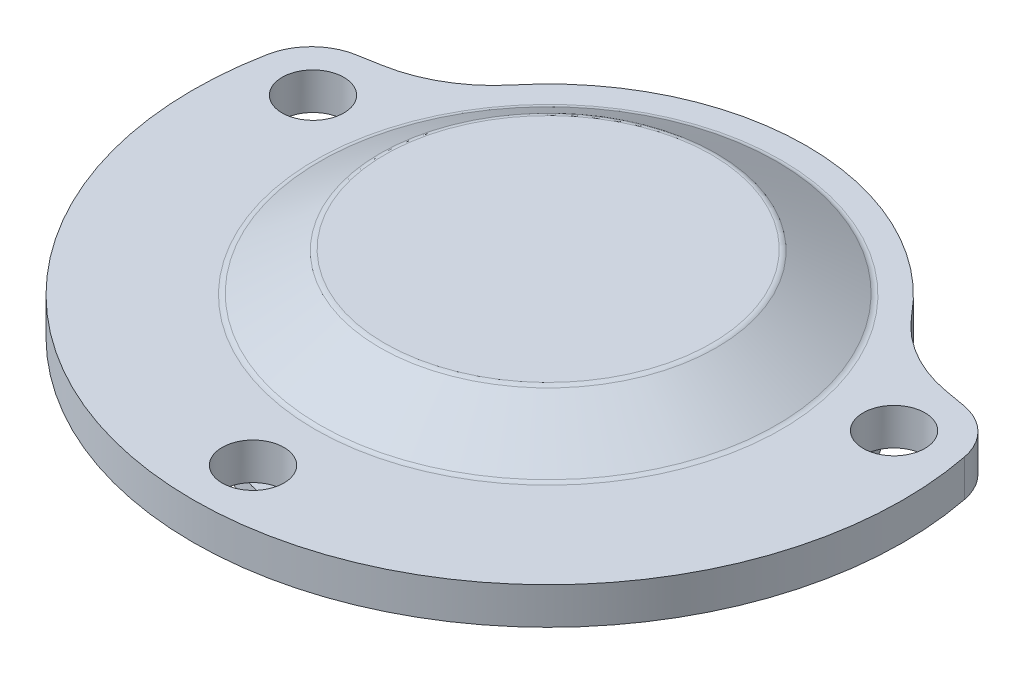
SolidWorks part; units mm, degrees
ref_plane "Piano frontale" through (0, 0, 0) normal (0, 0, 1) x (1, 0, 0)
ref_plane "Piano superiore" through (0, 0, 0) normal (0, 1, 0) x (1, 0, 0)
ref_plane "Piano destro" through (0, 0, 0) normal (1, 0, 0) x (0, 0, -1)
sketch "Schizzo1" plane through (0, 0, 0) normal (0, 0, 1) x (1, 0, 0)
  line L0 (0, 0) -> (0, 5) construction
  line L1 (0, 5) -> (0, 9.8)
  line L2 (0, 9.8) -> (18, 9.8)
  line L3 (18, 9.8) -> (25, 5.5)
  line L4 (25, 5.5) -> (38.5, 5.5)
  line L5 (38.5, 5.5) -> (38.5, 1.5)
  line L6 (38.5, 1.5) -> (26, 1.5)
  line L7 (26, 1.5) -> (26, -0.2)
  line L8 (26, -0.2) -> (23.9, -0.2)
  line L9 (23.9, -0.2) -> (23.9, -3.5)
  line L10 (23.9, -3.5) -> (26, -3.5)
  line L11 (26, -3.5) -> (26, -5.5)
  line L12 (26, -5.5) -> (19, -5.5)
  line L13 (19, -5.5) -> (19, 5)
  line L14 (19, 5) -> (0, 5)
  dimension "D1" = 15.3
  dimension "D2" = 18
  dimension "D3" = 10.5
  dimension "D4" = 19
  dimension "D5" = 38.5
  dimension "D6" = 25
  dimension "D7" = 7
  dimension "D8" = 4
  dimension "D9" = 5
  dimension "D10" = 23.9
  dimension "D11" = 26
  dimension "D12" = 3.3
  dimension "D13" = 2
  dimension "D14" = 0
revolve "Rivoluzione1" add sketch "Schizzo1" angle 360 about L0
sketch "Schizzo4" plane through (0, 5.5, 0) normal (0, 1, 0) x (1, 0, 0)
  line L0 (-31.5, 6) -> (31.5, 6) construction
  line L2 (0, -32) -> (0, 0) construction
  point P0 (0, -32)
  point P2 (-31.5, 6)
  point P4 (31.5, 6)
  dimension "D1" = 32
  dimension "D2" = 38
  dimension "D3" = 31.5
  dimension "D4" = 31.5
hole_wizard "Foro Ø6.7 (6.7)-1" positions "Schizzo4" profile "Schizzo3" hole size "Ø6.7" standard "Ansi Metric"
sketch "Schizzo3" plane through (0, 5.5, 32) normal (1, 0, 0) x (0, 0, 1)
  line L0 (0, 0) -> (0, 11)
  line L1 (0, 11) -> (3.35, 11)
  line L2 (3.35, 11) -> (3.35, 0)
  line L5 (3.35, 0) -> (0, 0)
  line L11 (0, -6.35) -> (0, 107.95) construction
  dimension "Thru Hole Dia." = 6.7
  dimension "Thru Hole Depth" = 11
sketch "Schizzo5" plane through (0, 0, 0) normal (0, 1, 0) x (1, 0, 0)
  line L0 (-45, 10) -> (-24.4635, 13.6211)
  line L1 (45, 10) -> (24.4635, 13.6211)
  line L2 (0, 18) -> (0, 0) construction
  line L3 (-45, 10) -> (45, 10) construction
  line L6 (-45, 10) -> (-45, 45)
  line L7 (-45, 45) -> (45, 45)
  line L8 (45, 10) -> (45, 45)
  circle A2 centre (0, 0) radius 18 construction
  arc A6 (24.4635, 13.6211) -> (-24.4635, 13.6211) centre (0, 0) ccw
  dimension "D1" = 28
  dimension "D2" = 80
  dimension "D3" = 80
  dimension "D4" = 90
  dimension "D5" = 35
  dimension "D6" = 10
  dimension "D7" = 45
extrude "Taglio-Estrusione2" cut sketch "Schizzo5" along normal blind 10
fillet "Raccordo1" radius 6 2 edges at (36.7569, 3.5, -11.4535) (-36.7569, 3.5, -11.4535)
fillet "Raccordo2" radius 15 2 edges at (24.4635, 3.5, -13.6211) (-24.4635, 3.5, -13.6211)
fillet "Raccordo3" radius 1 2 edges at (0, 5.5, -25) (0, 9.8, -18)
fillet "Raccordo4" radius 1 1 edges at (0, 5, -19)
